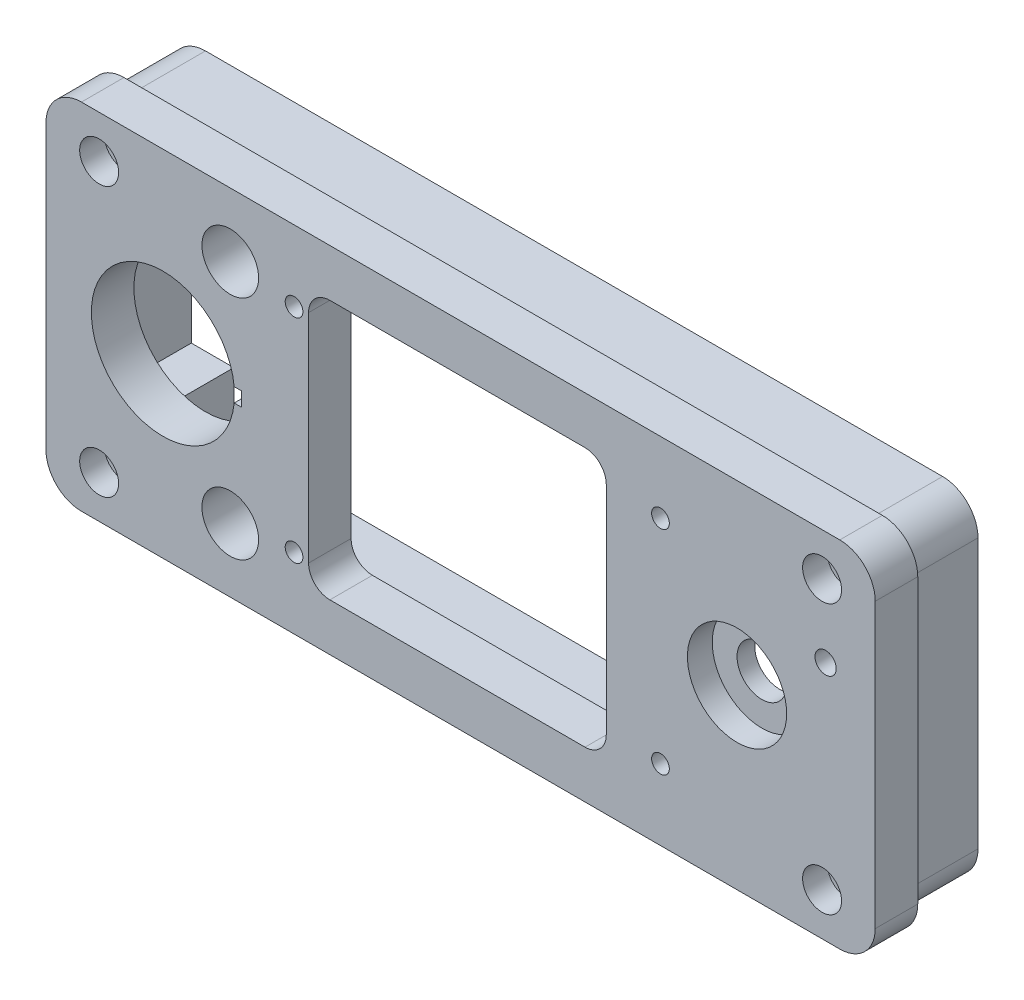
SolidWorks part; units mm, degrees
ref_plane "Front Plane" through (0, 0, 0) normal (0, 0, 1) x (1, 0, 0)
ref_plane "Top Plane" through (0, 0, 0) normal (0, 1, 0) x (1, 0, 0)
ref_plane "Right Plane" through (0, 0, 0) normal (1, 0, 0) x (0, 0, -1)
sketch "Sketch1" plane through (0, 0, 0) normal (0, 0, 1) x (1, 0, 0)
  line L0 (5, 0) -> (112, 0)
  line L1 (0, 5) -> (0, 45)
  line L2 (5, 50) -> (112, 50)
  line L3 (117, 45) -> (117, 5)
  line L4 (58.5, 50) -> (58.5, 0) construction
  line L5 (0, 25) -> (117, 25) construction
  line L6 (39.0504, 8.7001) -> (77.0504, 8.7001) construction
  line L7 (77.0504, 8.7001) -> (77.0504, 41.3001) construction
  line L8 (77.0504, 41.3001) -> (39.0504, 41.3001) construction
  line L9 (39.0504, 41.3001) -> (39.0504, 8.7001) construction
  line L10 (40.0504, 43.3001) -> (76.0504, 43.3001)
  line L11 (79.0504, 40.3001) -> (79.0504, 9.7001)
  line L12 (76.0504, 6.7001) -> (40.0504, 6.7001)
  line L13 (37.0504, 9.7001) -> (37.0504, 40.3001)
  line L14 (27.5504, 26) -> (26.5504, 26)
  line L15 (27.5504, 26) -> (27.5504, 24)
  line L16 (27.5504, 24) -> (26.5504, 24)
  line L17 (26, 41) -> (26, 2.6576) construction
  circle A0 centre (109.5, 44) radius 1.75
  circle A1 centre (7.5, 44) radius 1.75
  circle A2 centre (109.5, 6) radius 1.75
  circle A3 centre (7.5, 6) radius 1.75
  arc A4 (5, 0) -> (0, 5) centre (5, 5) cw
  arc A5 (112, 0) -> (117, 5) centre (112, 5) ccw
  arc A6 (117, 45) -> (112, 50) centre (112, 45) ccw
  arc A7 (5, 50) -> (0, 45) centre (5, 45) ccw
  circle A8 centre (97.5001, 24.9999) radius 3.5
  circle A9 centre (86.7004, 40) radius 1.25
  arc A10 (40.0504, 6.7001) -> (37.0504, 9.7001) centre (40.0504, 9.7001) cw
  circle A11 centre (86.7004, 10) radius 1.25
  circle A12 centre (35.0004, 10) radius 1.25
  circle A13 centre (35.0004, 40) radius 1.25
  arc A14 (79.0504, 9.7001) -> (76.0504, 6.7001) centre (76.0504, 9.7001) cw
  arc A15 (76.0504, 43.3001) -> (79.0504, 40.3001) centre (76.0504, 40.3001) cw
  arc A16 (40.0504, 43.3001) -> (37.0504, 40.3001) centre (40.0504, 40.3001) ccw
  circle A17 centre (110, 34) radius 1.5
  circle A18 centre (26, 41) radius 6 construction
  arc A19 (26.5504, 26) -> (26.5504, 24) centre (16.5, 25) ccw
  circle A20 centre (26, 9) radius 6 construction
  circle A21 centre (26, 41) radius 4
  circle A22 centre (26, 9) radius 4
  point P19 (0, 0)
  dimension "D1" = 51
  dimension "D2" = 19
  dimension "D3" = 5
  dimension "D4" = 38
  dimension "D10" = 3
  dimension "D11" = 7
  dimension "D12" = 16.5
  dimension "D16" = 10.1
  dimension "D15" = 26
  dimension "D5" = 32.6
  dimension "D6" = 2
  dimension "D7" = 2
  dimension "D8" = 2
  dimension "D9" = 2
  dimension "D13" = 1
  dimension "D14" = 1
extrude "Boss-Extrude1" add sketch "Sketch1" along normal blind 6
sketch "Sketch2" plane through (0, 0, 6) normal (0, 0, 1) x (1, 0, 0)
  circle A0 centre (7.5, 44) radius 2.75
  circle A1 centre (7.5, 6) radius 2.75
  circle A2 centre (109.5, 44) radius 2.75
  circle A3 centre (109.5, 6) radius 2.75
  circle A4 centre (97.5001, 24.9999) radius 7
extrude "Cut-Extrude1" cut sketch "Sketch2" against normal blind 3.5
sketch "Sketch3" plane through (0, 0, 0) normal (0, 0, -1) x (-1, 0, 0)
  line L0 (-110.5, 1) -> (-6.5, 1)
  line L1 (-1.5, 6) -> (-1.5, 44)
  line L2 (-6.5, 49) -> (-110.5, 49)
  line L3 (-115.5, 44) -> (-115.5, 6)
  line L4 (0, 45) -> (0, 5) construction
  line L5 (-117, 5) -> (-117, 45) construction
  line L6 (-5, 0) -> (-112, 0) construction
  line L7 (-112, 50) -> (-5, 50) construction
  line L8 (-10.5, 2.8) -> (-10.5, 12.3)
  line L9 (-106.5, 2.8) -> (-106.5, 12.3)
  line L10 (-106.5, 2.8) -> (-10.5, 2.8)
  line L11 (-10.5, 12.3) -> (-4.5, 12.3)
  line L12 (-106.5, 47.2) -> (-10.5, 47.2)
  line L13 (-10.5, 47.2) -> (-10.5, 37.7)
  line L14 (-106.5, 47.2) -> (-106.5, 37.7)
  line L15 (-106.5, 12.3) -> (-112.5, 12.3)
  line L16 (-112.5, 12.3) -> (-112.5, 37.7)
  line L17 (-112.5, 37.7) -> (-106.5, 37.7)
  line L18 (-4.5, 12.3) -> (-4.5, 37.7)
  line L19 (-4.5, 37.7) -> (-10.5, 37.7)
  arc A0 (-110.5, 1) -> (-115.5, 6) centre (-110.5, 6) cw
  arc A1 (-6.5, 1) -> (-1.5, 6) centre (-6.5, 6) ccw
  arc A2 (-1.5, 44) -> (-6.5, 49) centre (-6.5, 44) ccw
  arc A3 (-110.5, 49) -> (-115.5, 44) centre (-110.5, 44) ccw
  point P14 (-115.5, 1)
  point P17 (-1.5, 1)
  point P20 (-1.5, 49)
  dimension "D7" = 5
  dimension "D1" = 114
  dimension "D2" = 1.5
  dimension "D3" = 1.5
  dimension "D4" = 48
  dimension "D5" = 1
  dimension "D6" = 1
  dimension "D8" = 9
  dimension "D9" = 96
  dimension "D10" = 9
  dimension "D11" = 1.8
  dimension "D12" = 3
  dimension "D13" = 1.8
  dimension "D14" = 3
extrude "Boss-Extrude2" add sketch "Sketch3" along normal blind 10 separate body
